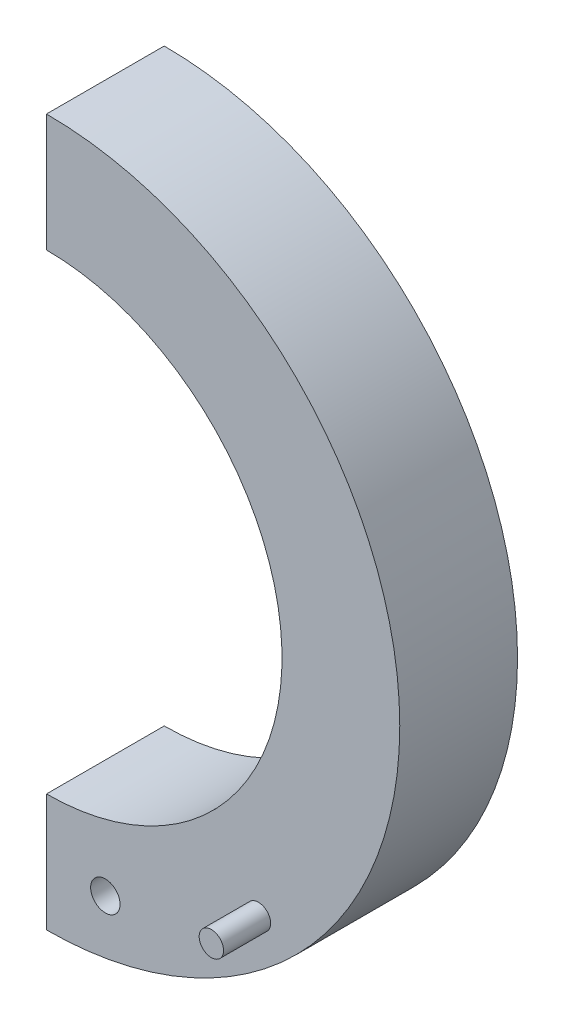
SolidWorks part; units mm, degrees
ref_plane "Front Plane" through (0, 0, 0) normal (0, 0, 1) x (1, 0, 0)
ref_plane "Top Plane" through (0, 0, 0) normal (0, 1, 0) x (1, 0, 0)
ref_plane "Right Plane" through (0, 0, 0) normal (1, 0, 0) x (0, 0, -1)
sketch "Sketch1" plane through (0, 0, 0) normal (0, 0, 1) x (1, 0, 0)
  line L0 (0, 19.05) -> (0, 12.7)
  line L1 (0, -12.7) -> (0, -19.05)
  arc A0 (0, 12.7) -> (0, -12.7) centre (0, 0) cw
  arc A1 (0, 19.05) -> (0, -19.05) centre (0, 0) cw
  dimension "D1" = 6.35
  dimension "D2" = 25.4
  dimension "D3" = 12.7
extrude "Finger" add sketch "Sketch1" along normal blind 6.35
sketch "Sketch2" plane through (0, 0, 6.35) normal (0, 0, 1) x (1, 0, 0)
  line L0 (0, -12.7) -> (0, -19.05) construction
  circle A0 centre (11.43, -12.7) radius 0.6578
  dimension "D1" = 11.43
  dimension "D2" = 6.35
extrude "Boss-Extrude1" add sketch "Sketch2" along normal blind 2.54 and the other way blind 8.89
sketch "Sketch3" plane through (0, 0, 6.35) normal (0, 0, 1) x (1, 0, 0)
  line L0 (0, -12.7) -> (0, -19.05) construction
  circle A0 centre (3.175, -15.875) radius 0.7938
  dimension "D1" = 1.5875
  dimension "D2" = 3.175
  dimension "D3" = 3.175
extrude "Cut-Extrude1" cut sketch "Sketch3" against normal through all
